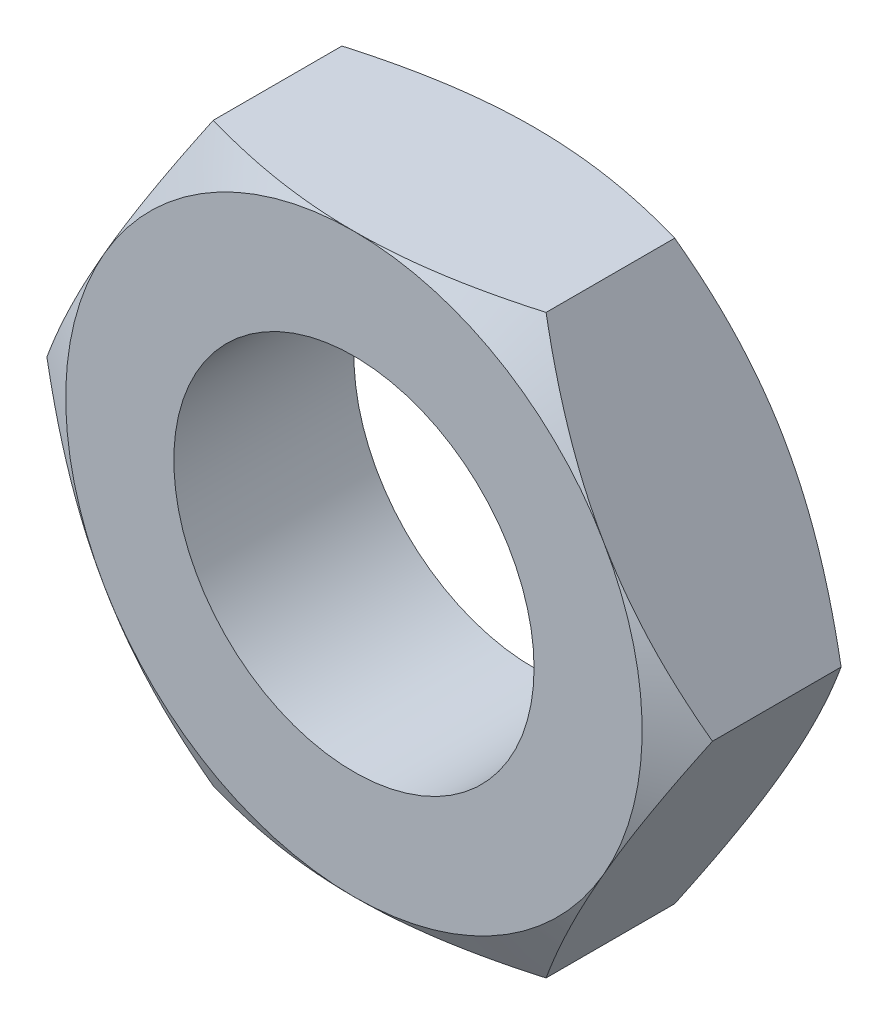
SolidWorks part; units mm, degrees
ref_plane "Front Plane" through (0, 0, 0) normal (0, 0, 1) x (1, 0, 0)
ref_plane "Top Plane" through (0, 0, 0) normal (0, 1, 0) x (1, 0, 0)
ref_plane "Right Plane" through (0, 0, 0) normal (1, 0, 0) x (0, 0, -1)
sketch "Sketch1" plane through (0, 0, 0) normal (0, 0, 1) x (1, 0, 0)
  line L1 (4.6188, 8) -> (-4.6188, 8)
  line L2 (-4.6188, 8) -> (-9.2376, 0)
  line L3 (-9.2376, 0) -> (-4.6188, -8)
  line L4 (-4.6188, -8) -> (4.6188, -8)
  line L5 (4.6188, -8) -> (9.2376, 0)
  line L6 (9.2376, 0) -> (4.6188, 8)
  circle A0 centre (0, 0) radius 8 construction
  circle A1 centre (0, 0) radius 5
  dimension "D2" = 10
  dimension "D1" = 16
extrude "Extrude1" add sketch "Sketch1" along normal mid plane 5
sketch "Sketch2" plane through (0, 0, 0) normal (1, 0, 0) x (0, 0, -1)
  line L0 (-2.5, 8) -> (-2.5, 16)
  line L1 (-2.5, 16) -> (2.1188, 16)
  line L2 (2.1188, 16) -> (-2.5, 8)
  dimension "D1" = 30
  dimension "D2" = 16
revolve "Cut-Revolve1" cut sketch "Sketch2" angle 360 about axis through (0, 0, 2.5) along (0, 0, -1)
mirror "Mirror1" about plane through (0, 0, 0) normal (0, 0, 1) of "Cut-Revolve1"
